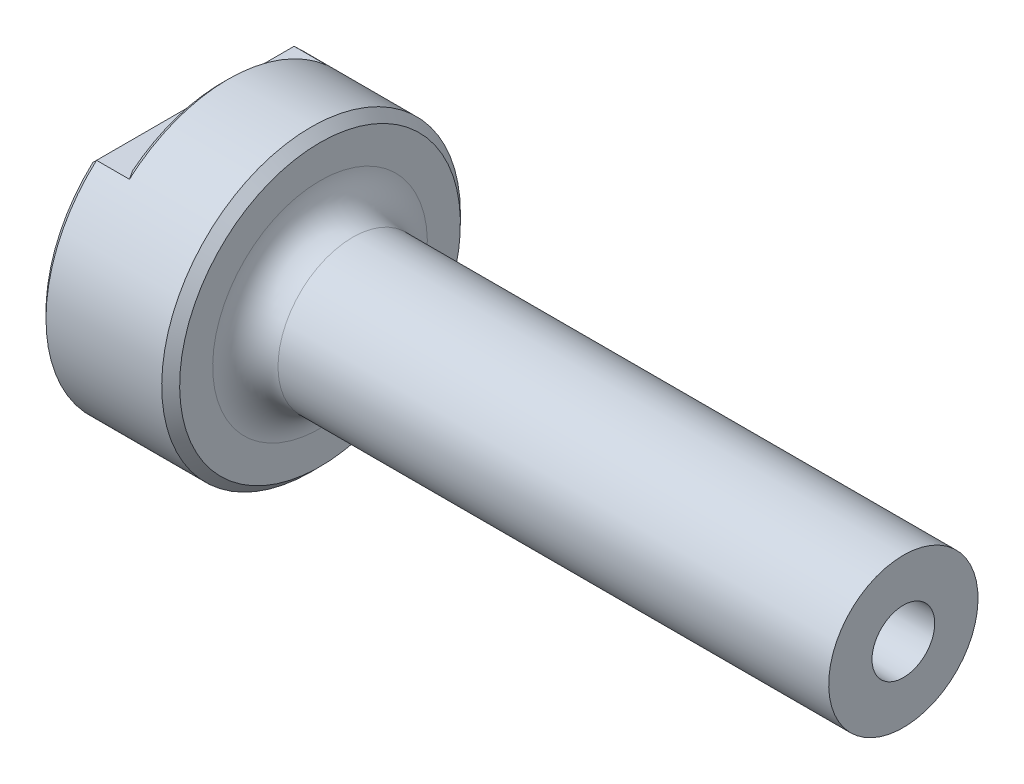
SolidWorks part; units mm, degrees
ref_plane "Front Plane" through (0, 0, 0) normal (0, 0, 1) x (1, 0, 0)
ref_plane "Top Plane" through (0, 0, 0) normal (0, 1, 0) x (1, 0, 0)
ref_plane "Right Plane" through (0, 0, 0) normal (1, 0, 0) x (0, 0, -1)
sketch "Sketch1" plane through (0, 0, 0) normal (1, 0, 0) x (0, 0, -1)
  circle A0 centre (0, 0) radius 25.4
  dimension "Rod Dia" = 50.8
extrude "Boss-Extrude1" add sketch "Sketch1" along normal mid plane 121.4438 contours A0
sketch "Sketch3" plane through (-60.7219, 0, 0) normal (-1, 0, 0) x (0, 0, 1)
  line L1 (-25.4, 25.4) -> (25.4, 25.4)
  line L2 (-25.4, 25.4) -> (-25.4, 19.05)
  line L3 (-25.4, 19.05) -> (25.4, 19.05)
  line L4 (25.4, 25.4) -> (25.4, 19.05)
  line L5 (-25.4, 25.4) -> (25.4, 19.05) construction
  line L6 (-25.4, 19.05) -> (25.4, 25.4) construction
  circle A0 centre (0, 0) radius 25.4 construction
  point P0 (0, 22.225)
  dimension "D1" = 19.05
extrude "Cut-Extrude1" cut sketch "Sketch3" against normal blind 5.588
sketch "Sketch5" plane through (0, 0, 0) normal (0, 0, 1) x (1, 0, 0)
  line L0 (60.7219, 0) -> (-60.7219, 0) construction
  line L1 (60.7219, -25.4) -> (60.7219, 25.4) construction
  line L2 (-60.7219, 19.05) -> (-60.7219, -25.4) construction
  line L3 (-38.4969, -12.7) -> (60.7219, -12.7)
  line L4 (60.7219, -12.7) -> (60.7219, -25.4)
  line L5 (60.7219, -25.4) -> (-38.4969, -25.4)
  line L6 (-60.7219, -25.4) -> (60.7219, -25.4) construction
  line L7 (-38.4969, -25.4) -> (-38.4969, -12.7)
  dimension "B" = 22.225
  dimension "D" = 25.4
revolve "Cut-Revolve1" cut sketch "Sketch5" angle 360 about L0
sketch "Sketch6" plane through (0, 0, 0) normal (0, 0, 1) x (1, 0, 0)
  line L0 (60.7219, 0) -> (-60.7219, 0) construction
  line L1 (60.7219, -12.7) -> (60.7219, 12.7) construction
  line L2 (-60.7219, 19.05) -> (-60.7219, -25.4) construction
  line L3 (-56.0991, 0) -> (-60.7219, 0)
  line L5 (-60.7219, 9.8005) -> (-60.7219, 0)
  arc A0 (-60.7219, 9.8005) -> (-56.0991, 0) centre (-68.7991, 0) cw
  dimension "D1" = 12.7
  dimension "D2" = 4.6228
revolve "Cut-Revolve2" cut sketch "Sketch6" angle 360 about L0
sketch "Sketch7" plane through (0, 0, 0) normal (0, 0, 1) x (1, 0, 0)
  line L0 (-56.4067, 2.7781) -> (60.7219, 5.3339)
  line L2 (60.7219, -12.7) -> (60.7219, 12.7) construction
  line L3 (-56.4067, 0) -> (60.7219, 0)
  line L4 (60.7219, 0) -> (-60.7219, 0) construction
  line L5 (-60.7219, 19.05) -> (-60.7219, -25.4) construction
  line L6 (60.7219, 5.3339) -> (60.7219, 0)
  line L7 (-56.4067, 2.7781) -> (-56.4067, 0)
  line L8 (60.7219, 0) -> (41.1743, 0.1051)
  arc A1 (-60.7219, -9.8005) -> (-60.7219, 9.8005) centre (-68.7991, 0) ccw construction
  dimension "D1" = 1.25
  dimension "D2" = 5.5562
revolve "Cut-Revolve3" cut sketch "Sketch7" angle 360 about L4
fillet "Fillet1" radius 5.5562 1 edges at (-38.4969, 12.7, 0)
chamfer "Chamfer1" distance 1.524 angle 45 1 edges at (-38.4969, 25.4, 0)
chamfer "Chamfer2" distance 1.016 angle 45 3 edges at (-55.1339, 25.4, 0) (-60.7219, -25.4, 0) (-60.7219, 19.05, 0)
